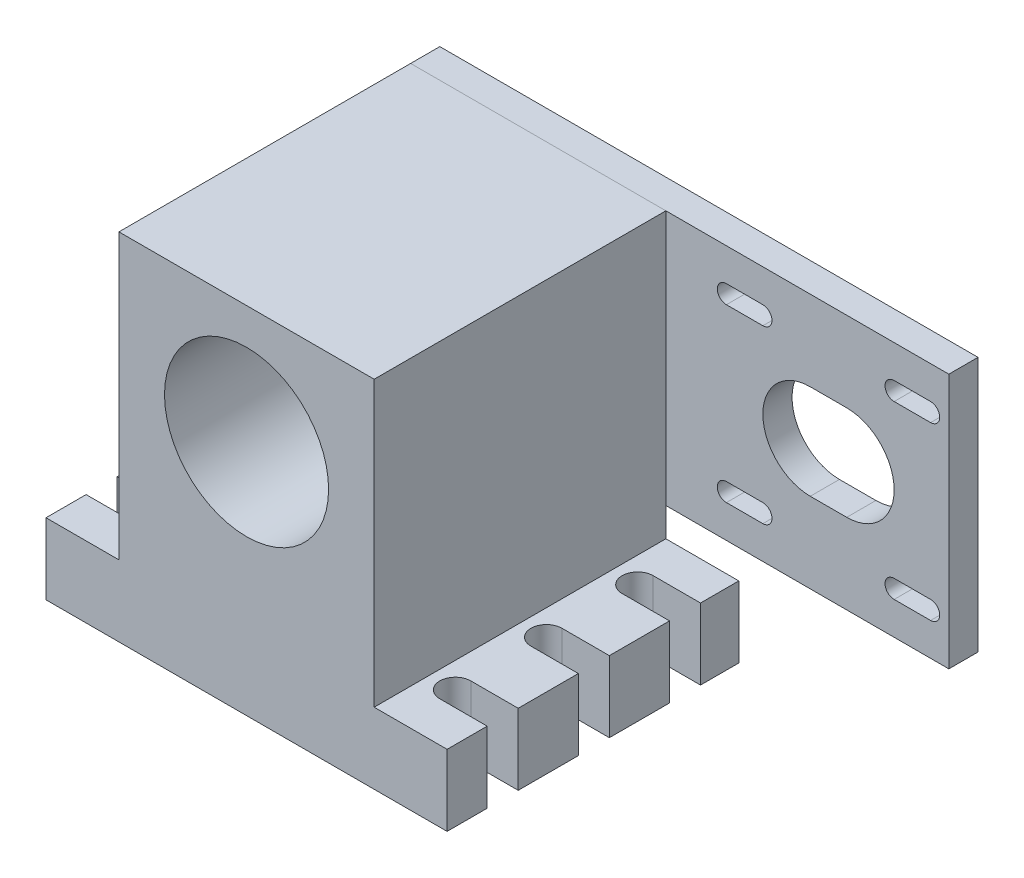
SolidWorks part; units mm, degrees
ref_plane "Front Plane" through (0, 0, 0) normal (0, 0, 1) x (1, 0, 0)
ref_plane "Top Plane" through (0, 0, 0) normal (0, 1, 0) x (1, 0, 0)
ref_plane "Right Plane" through (0, 0, 0) normal (1, 0, 0) x (0, 0, -1)
sketch "Sketch1" plane through (0, 0, 0) normal (0, 1, 0) x (1, 0, 0)
  line L1 (-55, 40) -> (55, 40)
  line L2 (-55, 40) -> (-55, -40)
  line L3 (-55, -40) -> (55, -40)
  line L4 (55, 40) -> (55, -40)
  line L5 (-55, 40) -> (55, -40) construction
  line L6 (-55, -40) -> (55, 40) construction
  point P0 (0, 0)
  dimension "D1" = 80
  dimension "D2" = 110
extrude "Boss-Extrude1" add sketch "Sketch1" along normal blind 19.5
sketch "Sketch2" plane through (0, 19.5, 0) normal (0, 1, 0) x (1, 0, 0)
  line L0 (0, 39.3225) -> (0, -44.673) construction
  line L1 (55, 29.5) -> (55, 21)
  line L2 (42, 29.5) -> (55, 29.5)
  line L3 (55, -40) -> (55, 40) construction
  line L4 (42, 21) -> (55, 21)
  line L5 (42, 4.5) -> (55, 4.5)
  line L6 (42, -4) -> (55, -4)
  line L7 (42, -20.5) -> (55, -20.5)
  line L8 (42, -29) -> (55, -29)
  line L10 (55, 4.5) -> (55, -4)
  line L11 (55, -20.5) -> (55, -29)
  line L12 (-55, -40) -> (55, -40) construction
  line L15 (-55, -20.5) -> (-55, -29)
  line L16 (-55, 4.5) -> (-55, -4)
  line L17 (-42, -29) -> (-55, -29)
  line L18 (-42, -20.5) -> (-55, -20.5)
  line L19 (-42, -4) -> (-55, -4)
  line L20 (-42, 4.5) -> (-55, 4.5)
  line L21 (-42, 21) -> (-55, 21)
  line L22 (-42, 29.5) -> (-55, 29.5)
  line L23 (-55, 29.5) -> (-55, 21)
  arc A0 (42, 29.5) -> (42, 21) centre (42, 25.25) ccw
  arc A1 (42, 4.5) -> (42, -4) centre (42, 0.25) ccw
  arc A2 (42, -20.5) -> (42, -29) centre (42, -24.75) ccw
  arc A3 (-42, -20.5) -> (-42, -29) centre (-42, -24.75) cw
  arc A4 (-42, 4.5) -> (-42, -4) centre (-42, 0.25) cw
  arc A5 (-42, 29.5) -> (-42, 21) centre (-42, 25.25) cw
  dimension "D3" = 8.5
  dimension "D4" = 8.5
  dimension "D5" = 8.5
  dimension "D1" = 25
  dimension "D2" = 25
  dimension "D6" = 42
  dimension "D8" = 11
extrude "Cut-Extrude1" cut sketch "Sketch2" against normal blind 19.5
sketch "Sketch3" plane through (0, 19.5, 0) normal (0, 1, 0) x (1, 0, 0)
  line L0 (-55, -40) -> (55, -40) construction
  line L1 (-35, 40) -> (35, 40)
  line L2 (-35, 40) -> (-35, -40)
  line L3 (-35, -40) -> (35, -40)
  line L4 (35, 40) -> (35, -40)
  line L5 (-35, 40) -> (35, -40) construction
  line L6 (-35, -40) -> (35, 40) construction
  point P0 (0, 0)
  dimension "D1" = 70
extrude "Boss-Extrude2" add sketch "Sketch3" along normal blind 77.9
sketch "Sketch4" plane through (0, 0, 40) normal (0, 0, 1) x (1, 0, 0)
  line L0 (0, 0) -> (0, 97.4) construction
  line L1 (-55, 0) -> (55, 0) construction
  line L2 (-35, 97.4) -> (35, 97.4) construction
  line L3 (-20.3538, 65) -> (17.2298, 65) construction
  circle A0 centre (0, 65) radius 22.5
  dimension "D2" = 45
  dimension "D1" = 65
extrude "Cut-Extrude2" cut sketch "Sketch4" against normal through all contours A0
sketch "Sketch5" plane through (0, 0, -40) normal (0, 0, -1) x (-1, 0, 0)
  line L1 (35, 97.4) -> (-112.6, 97.4)
  line L2 (35, 97.4) -> (35, 27.4)
  line L3 (35, 27.4) -> (-112.6, 27.4)
  line L4 (-112.6, 97.4) -> (-112.6, 27.4)
  dimension "D1" = 70
  dimension "D2" = 147.6
extrude "Boss-Extrude3" add sketch "Sketch5" along normal blind 8 separate body
sketch "Sketch6" plane through (0, 0, -40) normal (0, 0, 1) x (1, 0, 0)
  circle A0 centre (0, 65) radius 12.5
  dimension "D1" = 25
extrude "Cut-Extrude3" cut sketch "Sketch6" against normal through all
sketch "Sketch7" plane through (0, 0, -48) normal (0, 0, -1) x (-1, 0, 0)
  line L0 (-84.6, 62.4) -> (-74.6, 62.4) construction
  line L1 (-102.6, 85.9) -> (-56.6, 85.9) construction
  line L2 (-102.6, 85.9) -> (-102.6, 38.9) construction
  line L3 (-102.6, 38.9) -> (-56.6, 38.9) construction
  line L4 (-56.6, 85.9) -> (-56.6, 38.9) construction
  line L5 (-102.6, 85.9) -> (-56.6, 38.9) construction
  line L6 (-102.6, 38.9) -> (-56.6, 85.9) construction
  line L7 (-84.6, 75.4) -> (-74.6, 75.4)
  line L8 (-84.6, 49.4) -> (-74.6, 49.4)
  line L9 (-107.6, 85.9) -> (-97.6, 85.9) construction
  line L10 (-107.6, 88.4) -> (-97.6, 88.4)
  line L11 (-107.6, 83.4) -> (-97.6, 83.4)
  line L12 (-112.6, 97.4) -> (-112.6, 27.4) construction
  line L13 (35, 97.4) -> (-112.6, 97.4) construction
  line L15 (-61.6, 85.9) -> (-51.6, 85.9) construction
  line L16 (-61.6, 88.4) -> (-51.6, 88.4)
  line L17 (-61.6, 83.4) -> (-51.6, 83.4)
  line L18 (-61.6, 38.9) -> (-51.6, 38.9) construction
  line L19 (-61.6, 41.4) -> (-51.6, 41.4)
  line L20 (-61.6, 36.4) -> (-51.6, 36.4)
  line L21 (-107.6, 38.9) -> (-97.6, 38.9) construction
  line L22 (-107.6, 41.4) -> (-97.6, 41.4)
  line L23 (-107.6, 36.4) -> (-97.6, 36.4)
  arc A0 (-84.6, 75.4) -> (-84.6, 49.4) centre (-84.6, 62.4) ccw
  arc A1 (-74.6, 49.4) -> (-74.6, 75.4) centre (-74.6, 62.4) ccw
  arc A2 (-107.6, 88.4) -> (-107.6, 83.4) centre (-107.6, 85.9) ccw
  arc A3 (-97.6, 83.4) -> (-97.6, 88.4) centre (-97.6, 85.9) ccw
  arc A4 (-61.6, 88.4) -> (-61.6, 83.4) centre (-61.6, 85.9) ccw
  arc A5 (-51.6, 83.4) -> (-51.6, 88.4) centre (-51.6, 85.9) ccw
  arc A6 (-61.6, 41.4) -> (-61.6, 36.4) centre (-61.6, 38.9) ccw
  arc A7 (-51.6, 36.4) -> (-51.6, 41.4) centre (-51.6, 38.9) ccw
  arc A8 (-107.6, 41.4) -> (-107.6, 36.4) centre (-107.6, 38.9) ccw
  arc A9 (-97.6, 36.4) -> (-97.6, 41.4) centre (-97.6, 38.9) ccw
  point P6 (-79.6, 62.4)
  point P12 (-102.6, 85.9)
  point P23 (-56.6, 38.9)
  point P25 (-56.6, 85.9)
  point P37 (-102.6, 38.9)
  dimension "D1" = 26
  dimension "D3" = 5
  dimension "D2" = 10
  dimension "D4" = 10
  dimension "D5" = 28
  dimension "D6" = 10
  dimension "D7" = 9
  dimension "D8" = 22
extrude "Cut-Extrude4" cut sketch "Sketch7" against normal through all
